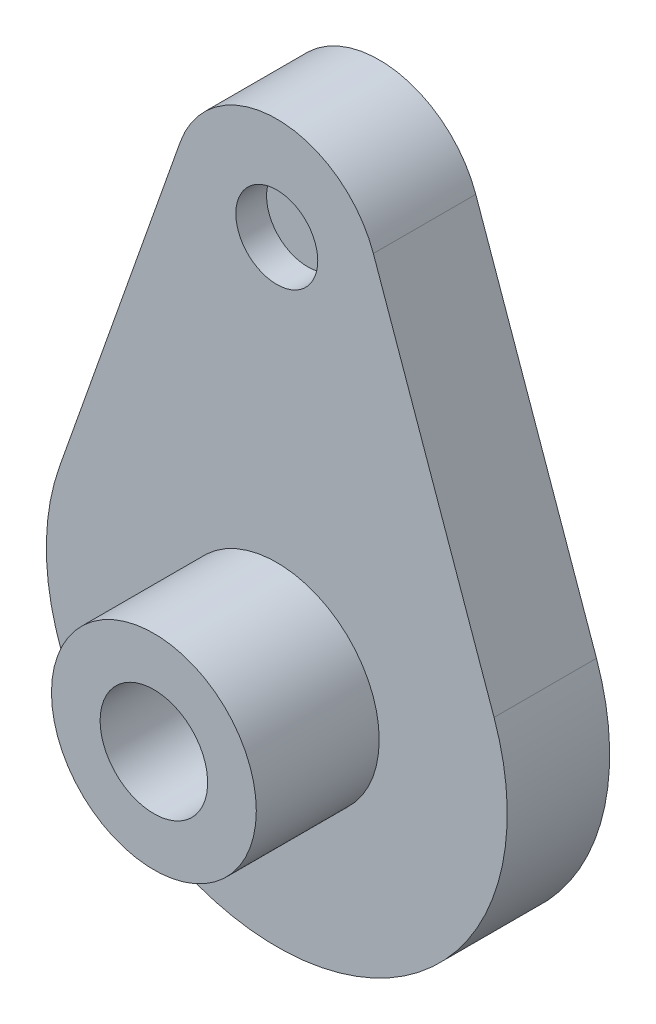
SolidWorks part; units mm, degrees
ref_plane "Přední rovina" through (0, 0, 0) normal (0, 0, 1) x (1, 0, 0)
ref_plane "Horní rovina" through (0, 0, 0) normal (0, 1, 0) x (1, 0, 0)
ref_plane "Pravá rovina" through (0, 0, 0) normal (1, 0, 0) x (0, 0, -1)
sketch "Skica1" plane through (0, 0, 0) normal (0, 0, 1) x (1, 0, 0)
  line L0 (-3.7712, 16.3333) -> (-8.4853, 3)
  line L1 (0, 15) -> (0, -25.0812) construction
  line L2 (3.7712, 16.3333) -> (8.4853, 3)
  arc A0 (-8.4853, 3) -> (8.4853, 3) centre (0, 0) ccw
  arc A1 (3.7712, 16.3333) -> (-3.7712, 16.3333) centre (0, 15) ccw
  dimension "D1" = 9
  dimension "D2" = 4
  dimension "D3" = 15
extrude "Přidat vysunutím1" add sketch "Skica1" along normal blind 4
sketch "Skica2" plane through (0, 0, 4) normal (0, 0, 1) x (1, 0, 0)
  circle A0 centre (0, 0) radius 4
  dimension "D1" = 8
extrude "Přidat vysunutím2" add sketch "Skica2" along normal blind 4.8
sketch "Skica3" plane through (0, 0, 0) normal (0, 0, -1) x (-1, 0, 0)
  circle A0 centre (0, 0) radius 2.1
  circle A1 centre (0, 15) radius 1.6
  dimension "D1" = 3.2
  dimension "D2" = 4.2
extrude "Odebrat vysunutím1" cut sketch "Skica3" against normal through all
sketch "Skica4" plane through (0, 0, 0) normal (0, 0, -1) x (-1, 0, 0)
  line L1 (3.2332, 15) -> (1.6166, 17.8)
  line L2 (1.6166, 17.8) -> (-1.6166, 17.8)
  line L3 (-1.6166, 17.8) -> (-3.2332, 15)
  line L4 (-3.2332, 15) -> (-1.6166, 12.2)
  line L5 (-1.6166, 12.2) -> (1.6166, 12.2)
  line L6 (1.6166, 12.2) -> (3.2332, 15)
  circle A0 centre (0, 15) radius 2.8 construction
  dimension "D1" = 5.6
extrude "Odebrat vysunutím2" cut sketch "Skica4" against normal blind 2.6
sketch "Skica5" plane through (0, 0, 2.6) normal (0, 0, -1) x (-1, 0, 0)
  circle A0 centre (0, 15) radius 1.6 construction
  circle A1 centre (0, 15) radius 1.6
extrude "Přidat vysunutím3" add sketch "Skica5" against normal blind 0.2
